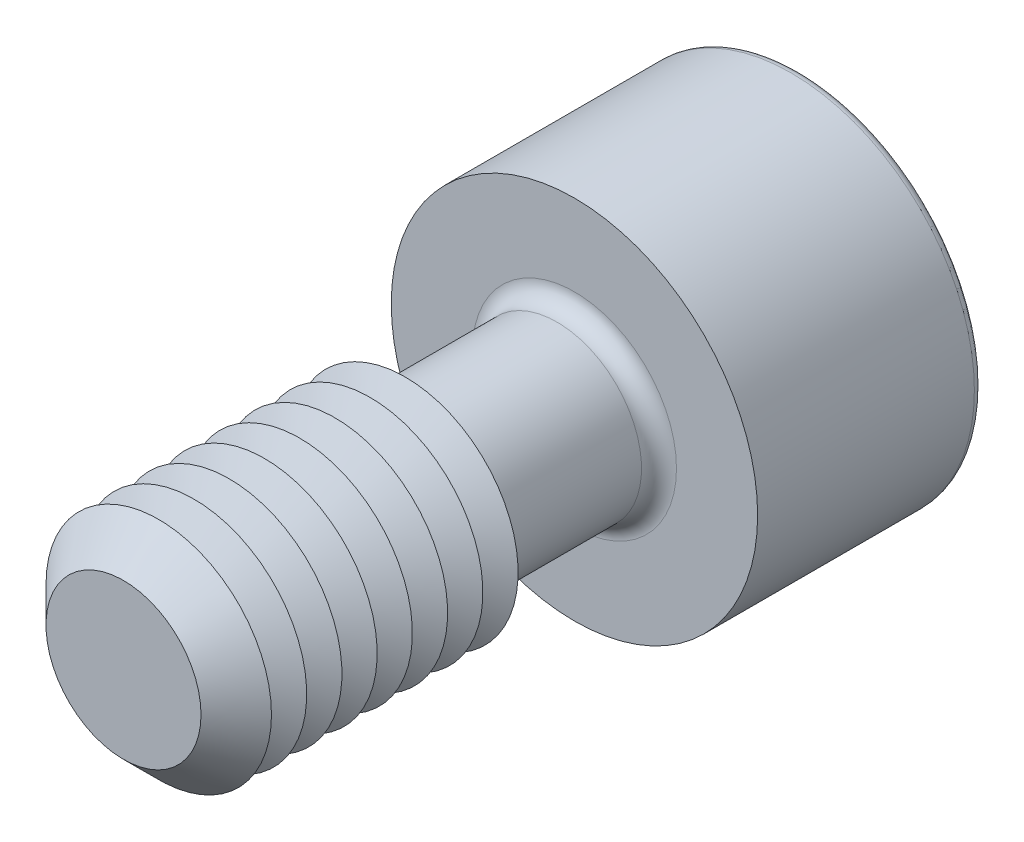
SolidWorks part; units mm, degrees
ref_plane "Front Plane" through (0, 0, 0) normal (0, 0, 1) x (1, 0, 0)
ref_plane "Top Plane" through (0, 0, 0) normal (0, 1, 0) x (1, 0, 0)
ref_plane "Right Plane" through (0, 0, 0) normal (1, 0, 0) x (0, 0, -1)
sketch "Sketch1" plane through (0, 0, 0) normal (0, 0, 1) x (1, 0, 0)
  circle A0 centre (0, 0) radius 3
  dimension "D1" = 6
extrude "Extrude1" add sketch "Sketch1" along normal mid plane 16
sketch "Sketch2" plane through (0, 0, 0) normal (1, 0, 0) x (0, 0, -1)
  line L0 (-8, 0) -> (-8, 4)
  line L1 (-8, 3) -> (-8, -3) construction
  line L2 (-8, 4) -> (2, 4)
  line L3 (2, 4) -> (2.5774, 3)
  line L4 (8, 3) -> (-8, 3) construction
  line L5 (2.5774, 3) -> (2.5774, 0)
  line L6 (2.5774, 0) -> (-8, 0)
  dimension "D1" = 4
  dimension "D2" = 120
  dimension "D3" = 10
revolve "Revolve1" add sketch "Sketch2" angle 360 about L6
chamfer "Chamfer1" distance 1.25 angle 45 1 edges at (0, 4, 8)
sketch "Sketch3" plane through (0, 0, -8) normal (0, 0, -1) x (-1, 0, 0)
  circle A0 centre (0, 0) radius 6.5
  dimension "D1" = 13
extrude "Extrude2" add sketch "Sketch3" along normal blind 8
sketch "Sketch4" plane through (-13.7, 0, -16) normal (0, 0, 1) x (1, 0, 0)
  line L2 (11.9679, -3) -> (15.4321, -3)
  line L3 (15.4321, -3) -> (17.1641, 0)
  line L4 (17.1641, 0) -> (15.4321, 3)
  line L6 (15.4321, 3) -> (11.9679, 3)
  line L7 (11.9679, 3) -> (10.2359, 0)
  line L8 (10.2359, 0) -> (11.9679, -3)
  circle A0 centre (13.7, 0) radius 3 construction
  dimension "D1" = 6
extrude "Extrude3" cut sketch "Sketch4" along normal blind 6
fillet "Fillet1" radius 0.62 1 edges at (-3, 0, -8)
fillet "Fillet2" radius 0.31 1 edges at (-6.5, 0, -16)
sketch "Sketch5" plane through (0, 0, 0) normal (1, 0, 0) x (0, 0, -1)
  line L0 (10, 0) -> (10, -3)
  line L1 (10, -3) -> (8.2679, 0)
  line L2 (8.2679, 0) -> (10, 0)
  dimension "D1" = 30
revolve "Cut-Revolve1" cut sketch "Sketch5" angle 360 about L2
sketch "Sketch6" plane through (0, 0, 0) normal (1, 0, 0) x (0, 0, -1)
  line L0 (1.332, 0) -> (-13.289, 0) construction
sketch "Sketch7" plane through (0, 0, 0) normal (1, 0, 0) x (0, 0, -1)
  line L0 (2, 4) -> (1.375, 2.9175)
  line L1 (1.375, 2.9175) -> (0.75, 4)
  line L2 (2, 4) -> (-6.75, 4) construction
  line L3 (0.75, 4) -> (2, 4)
  dimension "D1" = 1.25
revolve "Cut-Revolve2" cut sketch "Sketch7" angle 360 about L0
pattern_linear "LPattern1" count 7 spacing 1.25 along (0, 0, 1) of "Cut-Revolve2"
